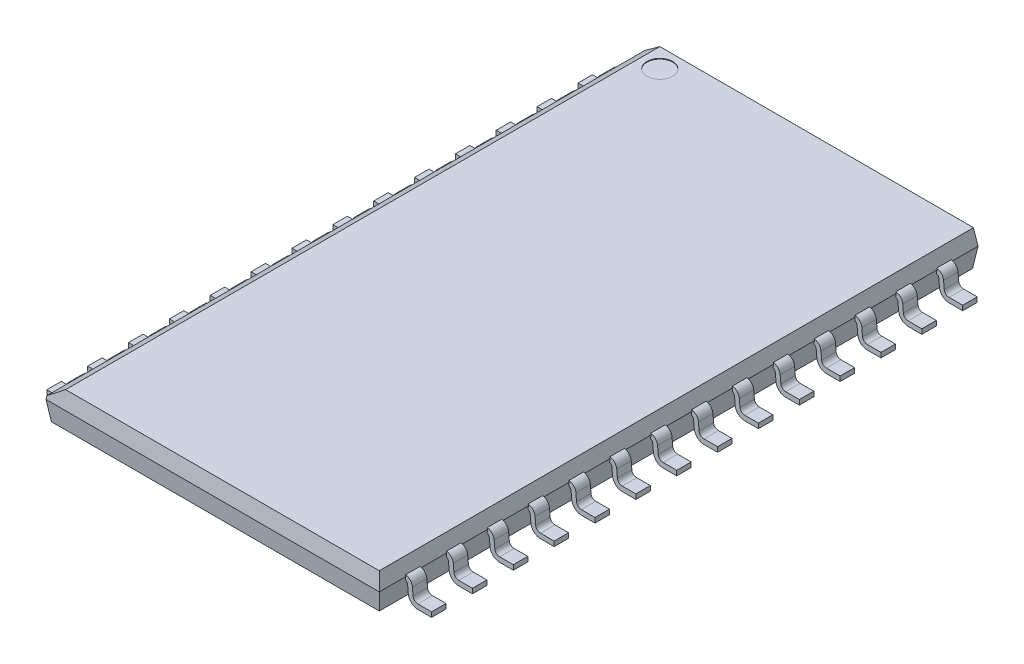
SolidWorks part; units mm, degrees
ref_plane "Front" through (0, 0, 0) normal (0, 0, 1) x (1, 0, 0)
ref_plane "Top" through (0, 0, 0) normal (0, 1, 0) x (1, 0, 0)
ref_plane "Right" through (0, 0, 0) normal (1, 0, 0) x (0, 0, -1)
ref_plane "ПлоскостьВывод1" through (0, 0, -8.255) normal (0, 0, 1) x (1, 0, 0)
sketch "ЭскизВывод1" plane through (0, 0, -8.255) normal (0, 0, 1) x (1, 0, 0)
  line L0 (-5.98, 0) -> (-5.5549, 0)
  line L1 (-5.256, 0.2739) -> (-5.2355, 0.5087)
  line L2 (-5.1359, 0.6) -> (5.1359, 0.6)
  line L3 (0, 0.6) -> (0, 0) construction
  line L4 (5.256, 0.2739) -> (5.2355, 0.5087)
  line L5 (5.98, 0) -> (5.5549, 0)
  arc A0 (-5.2355, 0.5087) -> (-5.1359, 0.6) centre (-5.1359, 0.5) cw
  arc A1 (-5.5549, 0) -> (-5.256, 0.2739) centre (-5.5549, 0.3) ccw
  arc A2 (5.5549, 0) -> (5.256, 0.2739) centre (5.5549, 0.3) cw
  arc A3 (5.2355, 0.5087) -> (5.1359, 0.6) centre (5.1359, 0.5) ccw
  point P8 (-5.2275, 0.6)
  point P11 (-5.28, 0)
  dimension "D6" = 0.1
  dimension "D7" = 0.3
  dimension "E" = 11.96
  dimension "A_mid_lead" = 0.6
  dimension "L" = 0.7
  dimension "D4" = 85
  dimension "D5" = 10.455
extrude "Вывод1" add sketch "ЭскизВывод1" along normal mid plane 0.45 thin
ref_plane "ПлоскостьКорпус" through (0, 0.7, 0) normal (0, 1, 0) x (-1, 0, 0)
sketch "ЭскизКорпус" plane through (0, 0.7, 0) normal (0, 1, 0) x (1, 0, 0)
  line L1 (5.18, -9.305) -> (-5.18, -9.305)
  line L2 (5.18, -9.305) -> (5.18, 9.305)
  line L3 (5.18, 9.305) -> (-5.18, 9.305)
  line L4 (-5.18, -9.305) -> (-5.18, 9.305)
  line L5 (5.18, -9.305) -> (-5.18, 9.305) construction
  line L6 (5.18, 9.305) -> (-5.18, -9.305) construction
  point P0 (0, 0)
  dimension "D" = 18.61
  dimension "E" = 10.36
extrude "Корпус" add sketch "ЭскизКорпус" along normal offset from surface 1.2 draft 8 and the other way offset from surface (0.6 mm away) 0.1 draft 8
pattern_linear "Выводы" count 14 spacing 1.27 along (0, 0, 1) of "Вывод1"
chamfer "Фаска1" distance 0.4 angle 45 1 edges at (-5.1097, 1.2, 0)
sketch "Эскиз3" plane through (0, 1.2, 0) normal (0, 1, 0) x (1, 0, 0)
  line L0 (-4.6397, 8.6347) -> (-4.0397, 8.6347) construction
  line L1 (-4.6397, 9.2347) -> (-4.6397, -9.2347) construction
  line L2 (-4.0397, 8.6347) -> (-4.0397, 9.2347) construction
  line L3 (5.1097, 9.2347) -> (-4.6397, 9.2347) construction
  circle A0 centre (-4.0397, 8.6347) radius 0.4
  dimension "D2" = 0.8
  dimension "D1" = 0.6
extrude "Вытянуть3" cut sketch "Эскиз3" against normal blind 0.02
sketch "SkThermalPad" plane through (0, 0.7, 0) normal (0, 1, 0) x (-1, 0, 0)
  line L1 (1.25, 1.25) -> (-1.25, 1.25)
  line L2 (1.25, 1.25) -> (1.25, -1.25)
  line L3 (1.25, -1.25) -> (-1.25, -1.25)
  line L4 (-1.25, 1.25) -> (-1.25, -1.25)
  line L5 (1.25, 1.25) -> (-1.25, -1.25) construction
  line L6 (1.25, -1.25) -> (-1.25, 1.25) construction
  point P0 (0, 0)
  dimension "D1" = 2.5
  dimension "E2" = 2.5
extrude "ThermalPad" [suppressed] add sketch "SkThermalPad" against normal up to surface (0.95 mm away)
